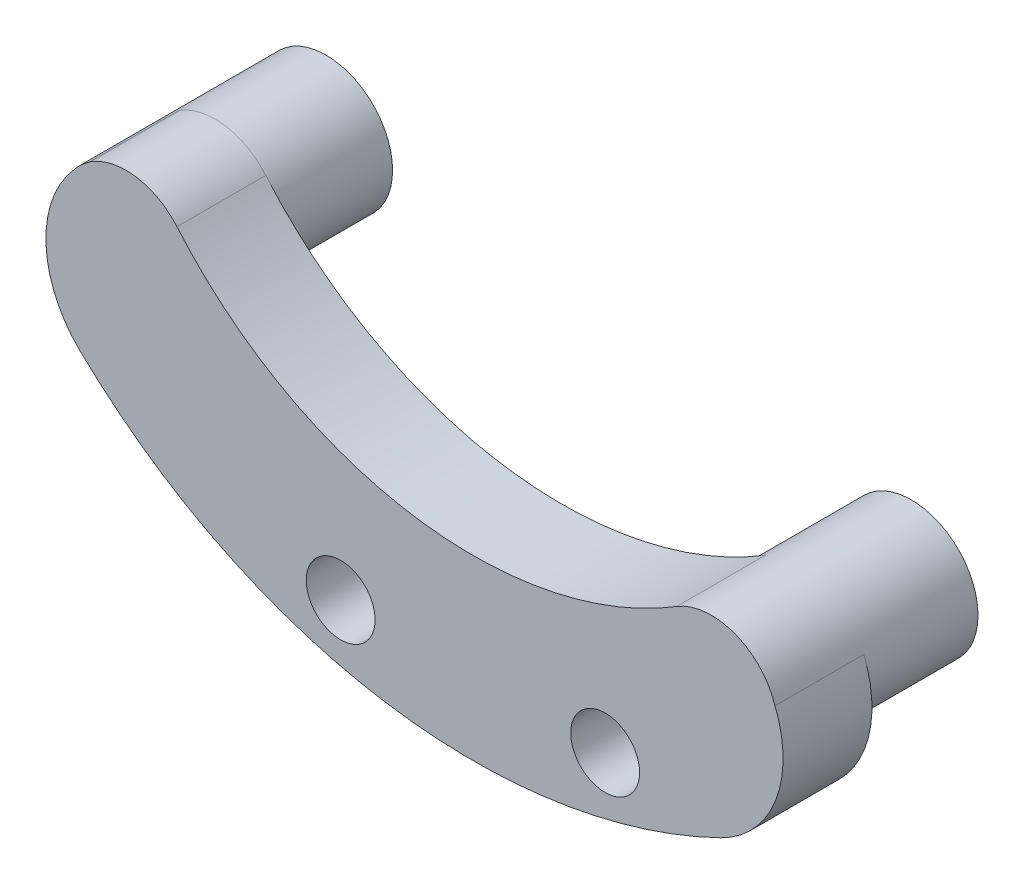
SolidWorks part; units mm, degrees
ref_plane "前视基准面" through (0, 0, 0) normal (0, 0, 1) x (1, 0, 0)
ref_plane "上视基准面" through (0, 0, 0) normal (0, 1, 0) x (1, 0, 0)
ref_plane "右视基准面" through (0, 0, 0) normal (1, 0, 0) x (0, 0, -1)
sketch "草图1" plane through (0, 0, 0) normal (0, 0, 1) x (1, 0, 0)
  line L0 (0, 0) -> (0, -41.1768) construction
  line L1 (5.9528, -22.2163) -> (0, 0) construction
  line L2 (-5.9528, -22.2163) -> (0, 0) construction
  line L3 (11.2488, -13.4058) -> (16.3911, -19.5341)
  line L4 (-14.8408, -9.2736) -> (-21.6252, -13.5129)
  arc A0 (-14.8408, -9.2736) -> (11.2488, -13.4058) centre (0, 0) ccw
  arc A1 (-21.6252, -13.5129) -> (16.3911, -19.5341) centre (0, 0) ccw
  arc A2 (-19.5051, -12.1881) -> (14.7841, -17.619) centre (0, 0) ccw construction
  circle A3 centre (5.9528, -22.2163) radius 1.55
  circle A4 centre (-5.9528, -22.2163) radius 1.55
  dimension "D1" = 35
  dimension "D2" = 51
  dimension "D3" = 46
  dimension "D4" = 3.1
  dimension "D6" = 15
  dimension "D7" = 15
  dimension "D8" = 40
  dimension "D9" = 58
extrude "凸台-拉伸1" add sketch "草图1" along normal blind 4
fillet "圆角1" radius 3 2 edges at (11.2488, -13.4058, 2) (-14.8408, -9.2736, 2)
fillet "圆角2" radius 5 2 edges at (16.3911, -19.5341, 2) (-21.6252, -13.5129, 2)
sketch "草图2" plane through (0, 0, 4) normal (0, 0, 1) x (1, 0, 0)
  circle A0 centre (-15.6081, -13.2905) radius 2.9918
  circle A1 centre (10.7371, -17.4632) radius 3
extrude "凸台-拉伸2" add sketch "草图2" against normal blind 9
